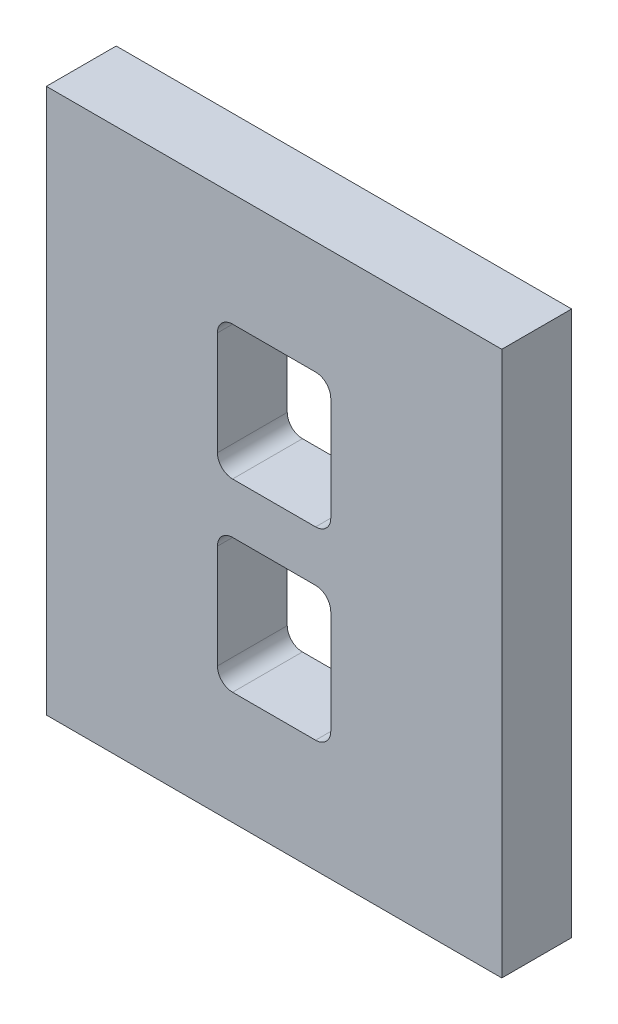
SolidWorks part; units mm, degrees
ref_plane "Front Plane" through (0, 0, 0) normal (0, 0, 1) x (1, 0, 0)
ref_plane "Top Plane" through (0, 0, 0) normal (0, 1, 0) x (1, 0, 0)
ref_plane "Right Plane" through (0, 0, 0) normal (1, 0, 0) x (0, 0, -1)
sketch "Sketch1" plane through (0, 0, 0) normal (0, 0, 1) x (1, 0, 0)
  line L1 (0, 0) -> (57.15, 0)
  line L2 (0, 0) -> (0, 68.326)
  line L3 (0, 68.326) -> (57.15, 68.326)
  line L4 (57.15, 0) -> (57.15, 68.326)
  dimension "D1" = 68.326
  dimension "D2" = 57.15
extrude "Boss-Extrude1" add sketch "Sketch1" along normal blind 8.763
sketch "Sketch2" plane through (0, 0, 8.763) normal (0, 0, 1) x (1, 0, 0)
  line L0 (-5.4577, 34.163) -> (63.0296, 34.163) construction
  line L1 (23.368, 14.1605) -> (33.782, 14.1605)
  line L2 (21.463, 16.0655) -> (21.463, 29.083)
  line L3 (23.368, 30.988) -> (33.782, 30.988)
  line L4 (35.687, 16.0655) -> (35.687, 29.083)
  line L5 (57.15, 68.326) -> (0, 68.326) construction
  line L6 (35.687, 52.2605) -> (35.687, 39.243)
  line L7 (23.368, 37.338) -> (33.782, 37.338)
  line L8 (21.463, 52.2605) -> (21.463, 39.243)
  line L9 (23.368, 54.1655) -> (33.782, 54.1655)
  line L10 (0, 68.326) -> (0, 0) construction
  arc A0 (23.368, 14.1605) -> (21.463, 16.0655) centre (23.368, 16.0655) cw
  arc A1 (33.782, 14.1605) -> (35.687, 16.0655) centre (33.782, 16.0655) ccw
  arc A2 (33.782, 30.988) -> (35.687, 29.083) centre (33.782, 29.083) cw
  arc A3 (21.463, 29.083) -> (23.368, 30.988) centre (23.368, 29.083) cw
  arc A4 (21.463, 39.243) -> (23.368, 37.338) centre (23.368, 39.243) ccw
  arc A5 (33.782, 37.338) -> (35.687, 39.243) centre (33.782, 39.243) ccw
  arc A6 (33.782, 54.1655) -> (35.687, 52.2605) centre (33.782, 52.2605) cw
  arc A7 (23.368, 54.1655) -> (21.463, 52.2605) centre (23.368, 52.2605) ccw
  dimension "D1" = 1.905
  dimension "D2" = 34.163
  dimension "D3" = 21.463
extrude "Cut-Extrude1" cut sketch "Sketch2" against normal through all
